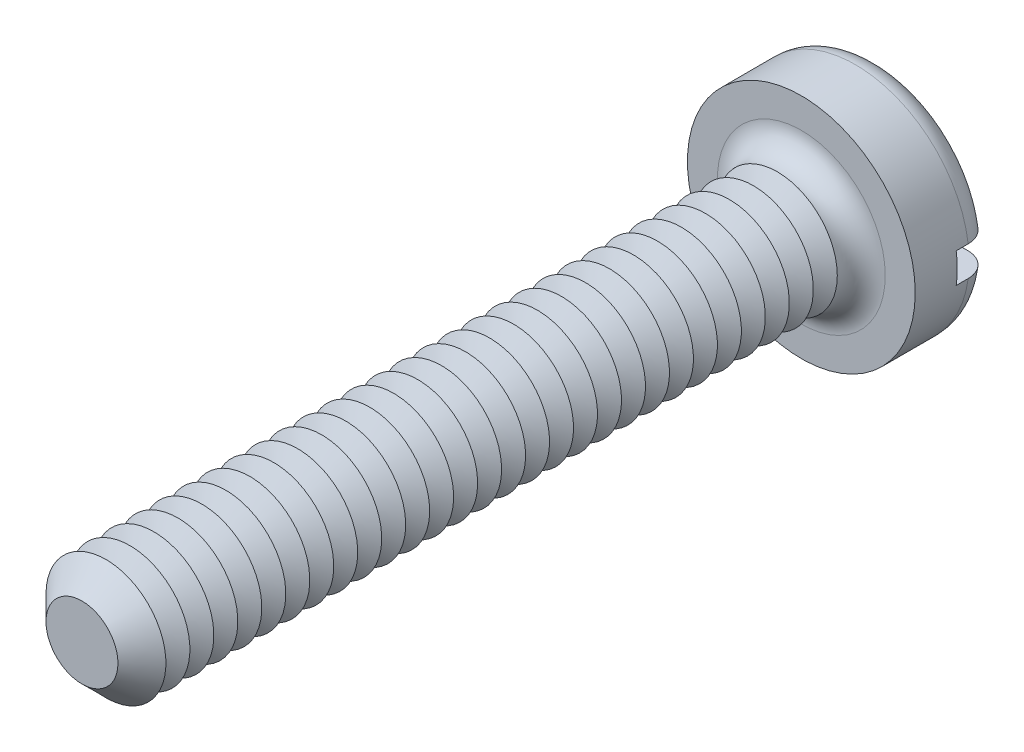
SolidWorks part; units mm, degrees
ref_plane "Front Plane" through (0, 0, 0) normal (0, 0, 1) x (1, 0, 0)
ref_plane "Top Plane" through (0, 0, 0) normal (0, 1, 0) x (1, 0, 0)
ref_plane "Right Plane" through (0, 0, 0) normal (1, 0, 0) x (0, 0, -1)
sketch "Sketch3" plane through (0, 0, 0) normal (0, 0, 1) x (1, 0, 0)
  circle A0 centre (0, 0) radius 1.9
  dimension "D1" = 3.8
extrude "Boss-Extrude2" add sketch "Sketch3" against normal blind 1.3
sketch "Sketch4" plane through (0, 0, 0) normal (0, 0, 1) x (1, 0, 0)
  circle A0 centre (0, 0) radius 1
  dimension "D1" = 2
extrude "Boss-Extrude3" add sketch "Sketch4" along normal blind 12
fillet "Fillet1" radius 0.4 2 edges at (1.9, 0, -1.3) (1, 0, 0)
chamfer "Chamfer1" distance 0.4 angle 45 1 edges at (1, 0, 12)
sketch "Sketch5" plane through (0, 0, 0) normal (1, 0, 0) x (0, 0, -1)
  line L0 (1.6944, 0) -> (-7.6738, 0) construction
sketch "Sketch6" plane through (0, 0, 0) normal (1, 0, 0) x (0, 0, -1)
  line L0 (-0.4, 1) -> (-0.6, 0.6536)
  line L1 (-0.6, 0.6536) -> (-0.8, 1)
  line L2 (-0.4, 1) -> (-11.6, 1) construction
  line L3 (-0.8, 1) -> (-0.4, 1)
  dimension "D1" = 0.4
revolve "Cut-Revolve1" cut sketch "Sketch6" angle 360 about L0
pattern_linear "LPattern1" count 28 spacing 0.4 along (0, 0, 1) of "Cut-Revolve1"
sketch "Sketch8" plane through (0, 0, -1.3) normal (0, 0, -1) x (-1, 0, 0)
  line L1 (1.9, -0.25) -> (-1.9, -0.25)
  line L2 (1.9, -0.25) -> (1.9, 0.25)
  line L3 (1.9, 0.25) -> (-1.9, 0.25)
  line L4 (-1.9, -0.25) -> (-1.9, 0.25)
  line L5 (1.9, -0.25) -> (-1.9, 0.25) construction
  line L6 (1.9, 0.25) -> (-1.9, -0.25) construction
  point P0 (0, 0)
  dimension "D1" = 3.8
  dimension "D2" = 0.5
extrude "Cut-Extrude1" cut sketch "Sketch8" against normal blind 0.6
